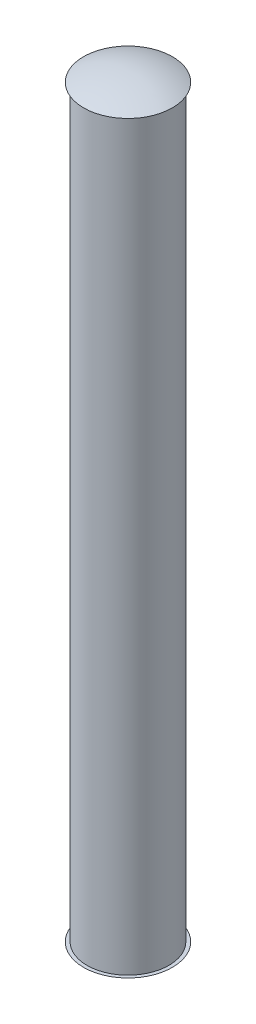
SolidWorks part; units mm, degrees
ref_plane "Front"
ref_plane "Top" through (0, 0, 0) normal (0, 1, 0) x (1, 0, 0)
ref_plane "Right" through (0, 0, 0) normal (1, 0, 0) x (0, 0, -1)
sketch "Sketch1" plane through (0, 0, 0) normal (0, 0, 1) x (1, 0, 0)
  line L0 (0, 74.1343) -> (0, -72.8337) construction
  line L1 (4.5437, 1.016) -> (4.191, 1.016)
  line L2 (4.191, 1.016) -> (4.191, 77.216)
  line L3 (4.191, 77.216) -> (4.5437, 77.216)
  line L4 (0, 0) -> (0, 78.232)
  arc A0 (0, 0) -> (4.5437, 1.016) centre (0.0284, 10.541) ccw
  arc A1 (4.5437, 77.216) -> (0, 78.232) centre (0, 67.564) ccw
  dimension "D1" = 10.541
  dimension "D4" = 10.668
  dimension "D2" = 1.016
  dimension "D3" = 1.016
  dimension "D5" = 4.191
  dimension "D6" = 76.2
revolve "Base-Revolve" add sketch "Sketch1" angle 360 about L0
